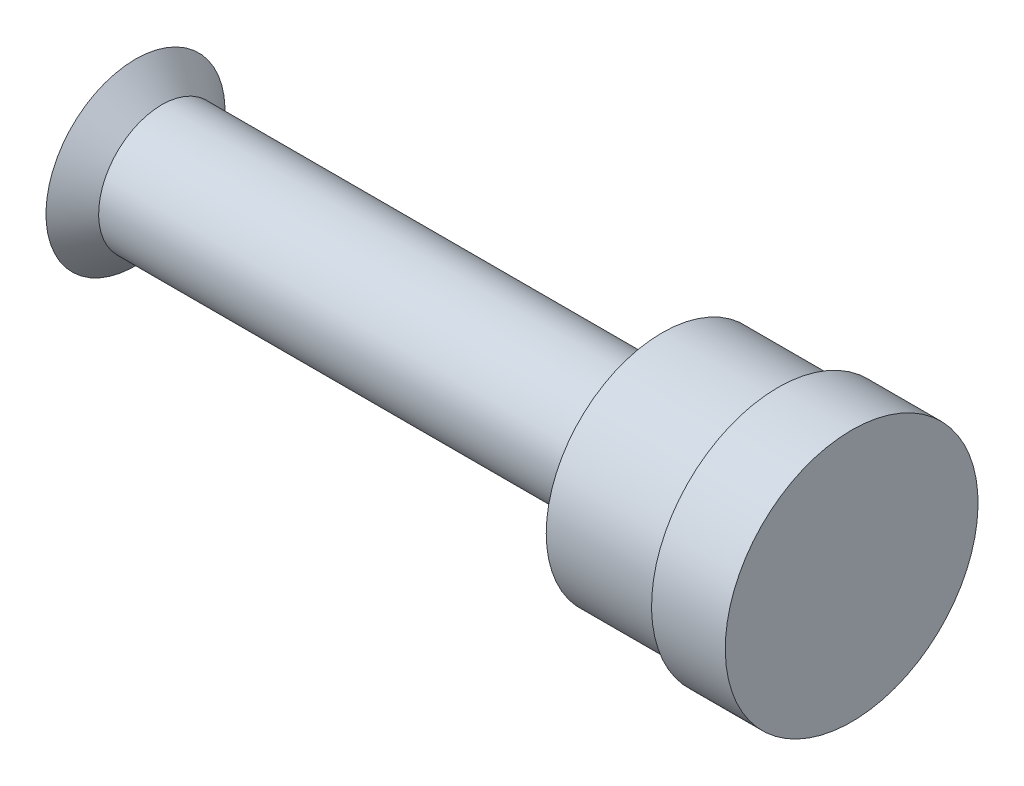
SolidWorks part; units mm, degrees
ref_plane "Přední rovina" through (0, 0, 0) normal (0, 0, 1) x (1, 0, 0)
ref_plane "Horní rovina" through (0, 0, 0) normal (0, 1, 0) x (1, 0, 0)
ref_plane "Pravá rovina" through (0, 0, 0) normal (1, 0, 0) x (0, 0, -1)
sketch "Skica1" plane through (0, 0, 0) normal (0, 0, 1) x (1, 0, 0)
  line L0 (0, 0) -> (0, 4.25)
  line L1 (0, 4.25) -> (1.25, 3)
  line L2 (1.25, 3) -> (25, 3)
  line L3 (25, 3) -> (25, 5.5)
  line L4 (25, 5.5) -> (30.5, 5.5)
  line L5 (30.5, 5.5) -> (30.5, 6)
  line L6 (30.5, 6) -> (34, 6)
  line L7 (34, 6) -> (34, 0)
  line L8 (34, 0) -> (0, 0)
  dimension "D1" = 6
  dimension "D2" = 5.5
  dimension "D3" = 3
  dimension "D4" = 45
  dimension "D5" = 4.25
  dimension "D6" = 3.5
  dimension "D7" = 9
  dimension "D8" = 25
revolve "Rotovat1" add sketch "Skica1" angle 360 about L8
